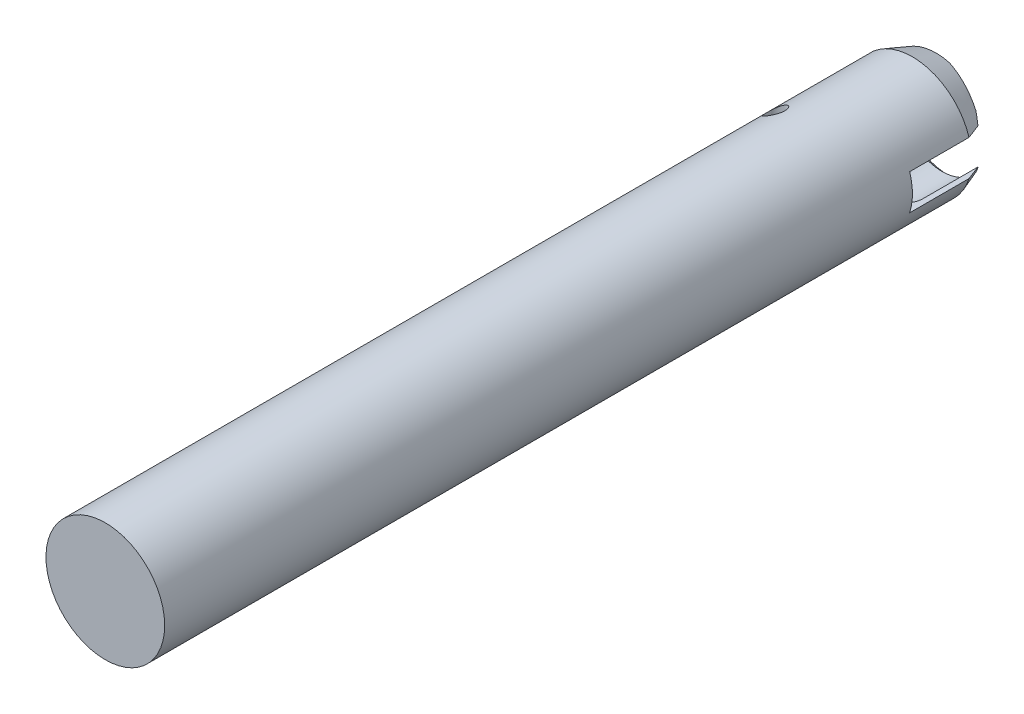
SolidWorks part; units mm, degrees
ref_plane "Front Plane" through (0, 0, 0) normal (0, 0, 1) x (1, 0, 0)
ref_plane "Top Plane" through (0, 0, 0) normal (0, 1, 0) x (1, 0, 0)
ref_plane "Right Plane" through (0, 0, 0) normal (1, 0, 0) x (0, 0, -1)
sketch "Sketch1" plane through (0, 0, 0) normal (0, 0, 1) x (1, 0, 0)
  circle A0 centre (0, 0) radius 2.5
  dimension "D1" = 5
extrude "Boss-Extrude1" add sketch "Sketch1" along normal blind 35
chamfer "Chamfer1" distance 1 angle 20 1 edges at (2.5, 0, 0)
sketch "Sketch3" plane through (0, 0, 0) normal (0, 0, -1) x (-1, 0, 0)
  line L0 (0, 0) -> (-0.5, 0) construction
  circle A0 centre (-0.5, 0) radius 1.8125
  dimension "D1" = 3.625
  dimension "D2" = 0.5
extrude "Cut-Extrude1" cut sketch "Sketch3" against normal blind 3.5
chamfer "Chamfer2" distance 0.25 angle 45 1 edges at (-1.3125, 0, 0)
sketch "Sketch4" plane through (0, 0, 0) normal (0, 0, -1) x (-1, 0, 0)
  line L0 (1.227, 0.55) -> (1.227, -0.55)
  line L1 (1.227, -0.55) -> (2.727, -0.55)
  line L2 (2.727, -0.55) -> (2.727, 0.55)
  line L3 (2.727, 0.55) -> (1.227, 0.55)
  line L5 (0, 0) -> (2.727, 0) construction
  circle A0 centre (-0.5, 0) radius 1.8125 construction
  dimension "D1" = 1.1
  dimension "D2" = 1.5
extrude "Cut-Extrude2" cut sketch "Sketch4" against normal blind 30
sketch "Sketch5" plane through (0, 0, 0) normal (0, 0, -1) x (-1, 0, 0)
  line L0 (-3.2907, -0.75) -> (-1.3682, -0.75)
  line L1 (-1.3682, -0.75) -> (-1.3682, 0.75)
  line L2 (-1.3682, 0.75) -> (-3.2907, 0.75)
  line L3 (-3.2907, 0.75) -> (-3.2907, -0.75)
  line L4 (0, 0) -> (-1.3682, 0) construction
  dimension "D1" = 1.5
extrude "Cut-Extrude3" cut sketch "Sketch5" against normal up to surface (3.5 mm away)
sketch "Sketch6" plane through (0, -0.55, 0) normal (0, 1, 0) x (1, 0, 0)
  line L0 (-1.227, -3.5) -> (-1.27, -3.5) construction
  line L1 (-1.27, -3.5) -> (-1.27, -5.5) construction
  line L2 (0, 0) -> (0, -3.7069) construction
  circle A0 centre (-1.27, -5.5) radius 0.3969
  dimension "D1" = 0.7937
  dimension "D2" = 2
  dimension "D3" = 1.27
extrude "Cut-Extrude4" cut sketch "Sketch6" against normal through all and the other way through all
fillet "Fillet1" radius 0.7937 2 edges at (0.3928, -1.8093, 3.5) (0.3928, 1.8093, 3.5)
sketch "Sketch7" plane through (-1.227, 0, 0) normal (-1, 0, 0) x (0, 0, 1)
  line L0 (30, 0.55) -> (30, -0.55) construction
  line L1 (6.5, 1.05) -> (30, 1.05)
  line L2 (6.5, 1.05) -> (6.5, -1.05)
  line L3 (6.5, -1.05) -> (30, -1.05)
  line L4 (30, 1.05) -> (30, -1.05)
  line L5 (0, 0) -> (6.5, 0) construction
  dimension "D1" = 2.1
  dimension "D2" = 6.5
extrude "Cut-Extrude5" cut sketch "Sketch7" along normal through all
sketch "Sketch8" plane through (-1.227, 0, 0) normal (-1, 0, 0) x (0, 0, 1)
  line L0 (6.5, 1.05) -> (6.5, -1.05)
  line L1 (6.5, -1.05) -> (30, -1.05)
  line L2 (30, -1.05) -> (30, 1.05)
  line L3 (30, 1.05) -> (30, -1.05) construction
  line L4 (30, 1.05) -> (6.5, 1.05) construction
  line L5 (30, 1.05) -> (6.5, 1.05)
extrude "Cut-Extrude6" cut sketch "Sketch8" against normal blind 2
